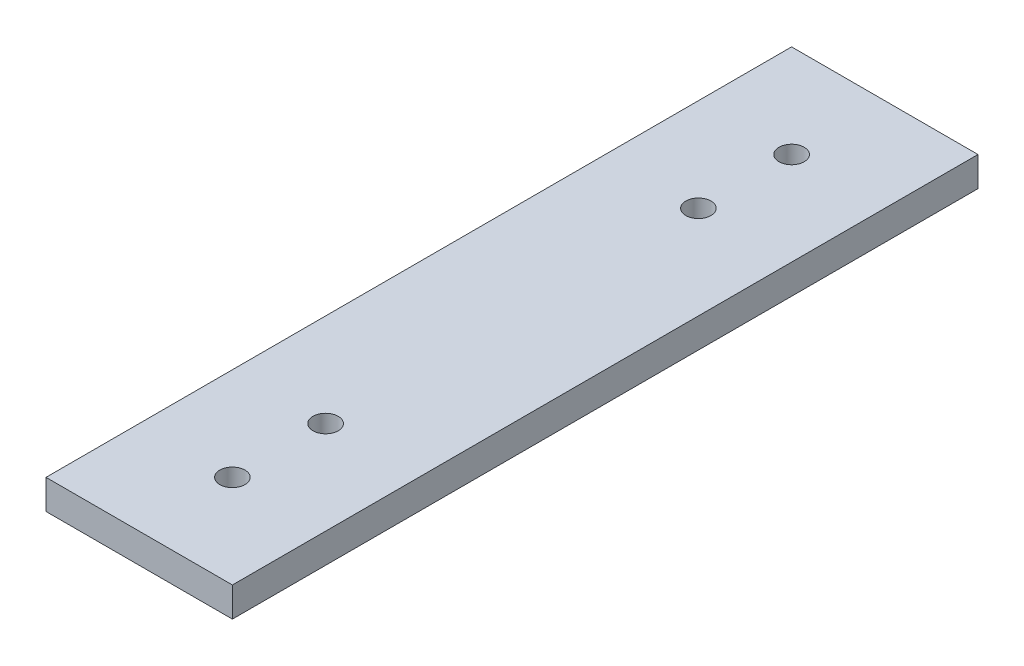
SolidWorks part; units mm, degrees
ref_plane "Front Plane" through (0, 0, 0) normal (0, 0, 1) x (1, 0, 0)
ref_plane "Top Plane" through (0, 0, 0) normal (0, 1, 0) x (1, 0, 0)
ref_plane "Right Plane" through (0, 0, 0) normal (1, 0, 0) x (0, 0, -1)
sketch "Sketch1" plane through (0, 0, 0) normal (0, 1, 0) x (1, 0, 0)
  line L0 (-10, 40) -> (10, -40) construction
  line L1 (-10, 40) -> (10, 40)
  line L2 (-10, 40) -> (-10, -40)
  line L3 (-10, -40) -> (10, -40)
  line L4 (10, 40) -> (10, -40)
  dimension "D1" = 20
  dimension "D2" = 80
extrude "Boss-Extrude1" add sketch "Sketch1" along normal blind 3.175
sketch "Sketch2" plane through (0, 0, 0) normal (0, -1, 0) x (1, 0, 0)
  line L0 (0, -30) -> (0, 0) construction
  point P0 (0, -30)
  point P8 (0, -20)
  dimension "D1" = 30
  dimension "D2" = 10
hole_wizard "Tap Drill for #6-32 Tap1" positions "Sketch6" profile "Sketch5" hole size "#6-32" standard "ANSI Inch"
sketch "Sketch6" plane through (0, 3.175, 0) normal (0, 1, 0) x (1, 0, 0)
  point P0 (0, 30)
  point P2 (0, 20)
sketch "Sketch5" plane through (0, 3.175, -30) normal (1, 0, 0) x (0, 0, 1)
  line L0 (0, 0) -> (0, 3.175)
  line L1 (0, 3.175) -> (1.3525, 3.175)
  line L2 (1.3525, 3.175) -> (1.3525, 0)
  line L5 (1.3525, 0) -> (0, 0)
  line L11 (0, -6.35) -> (0, 107.95) construction
  dimension "Thru Hole Dia." = 2.7051
  dimension "Thru Hole Depth" = 3.175
mirror "Mirror1" about plane through (0, 0, 0) normal (0, 0, 1) of "Tap Drill for #6-32 Tap1"
sketch "Sketch7" plane through (0, 3.175, 0) normal (0, 1, 0) x (1, 0, 0)
  line L0 (-10, 40) -> (-10, -40) construction
  line L1 (-10, -2.5) -> (10, -2.5)
  line L2 (-10, -2.5) -> (-10, 2.5)
  line L3 (-10, 2.5) -> (10, 2.5)
  line L4 (10, -2.5) -> (10, 2.5)
  line L5 (10, -40) -> (10, 40) construction
  line L7 (-55, 0) -> (55, 0) construction
  point P8 (-10, 0)
  dimension "D1" = 5
